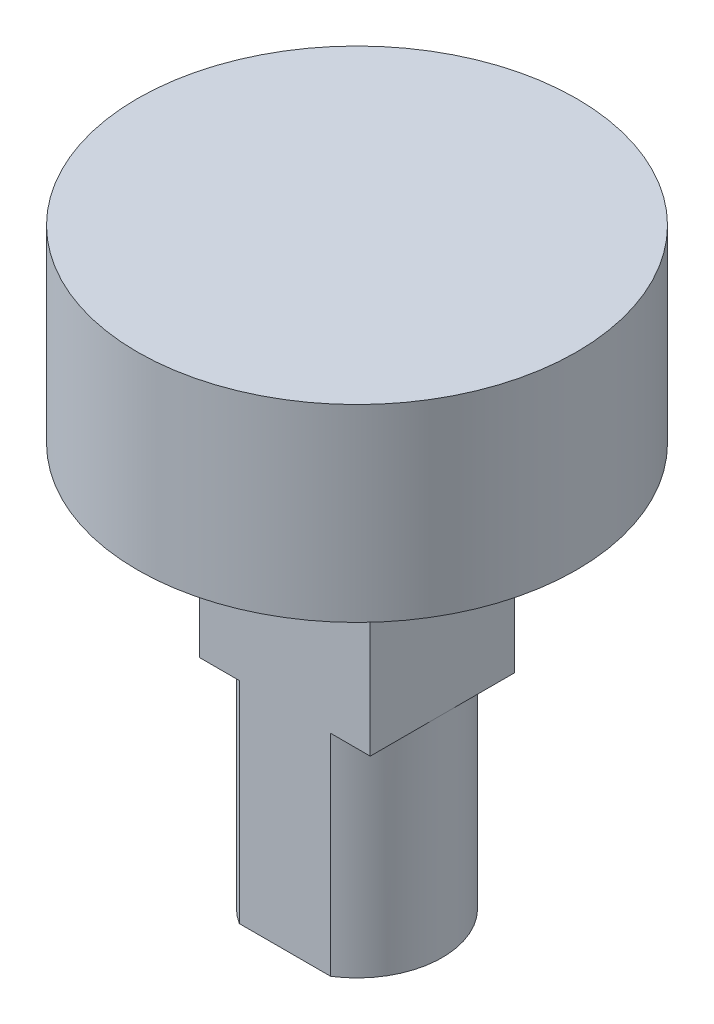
SolidWorks part; units mm, degrees
ref_plane "Front Plane" through (0, 0, 0) normal (0, 0, 1) x (1, 0, 0)
ref_plane "Top Plane" through (0, 0, 0) normal (0, 1, 0) x (1, 0, 0)
ref_plane "Right Plane" through (0, 0, 0) normal (1, 0, 0) x (0, 0, -1)
sketch "Sketch1" plane through (0, 0, 0) normal (0, 1, 0) x (1, 0, 0)
  line L1 (-5.969, -5.0419) -> (5.969, -5.0419)
  line L2 (-5.969, -5.0419) -> (-5.969, 5.0419)
  line L3 (-5.969, 5.0419) -> (5.969, 5.0419)
  line L4 (5.969, -5.0419) -> (5.969, 5.0419)
  line L5 (-5.969, -5.0419) -> (5.969, 5.0419) construction
  line L6 (-5.969, 5.0419) -> (5.969, -5.0419) construction
  point P0 (0, 0)
  dimension "D1" = 11.938
  dimension "D2" = 10.0838
extrude "Extrude1" add sketch "Sketch1" along normal blind 8.89
sketch "Sketch2" plane through (0, 0, 0) normal (0, -1, 0) x (1, 0, 0)
  line L0 (-5.969, 0) -> (5.969, 0) construction
  line L3 (0, -5.0419) -> (0, 5.0419) construction
  line L5 (5.969, -5.0419) -> (-5.969, -5.0419) construction
  line L6 (-5.969, 5.0419) -> (5.969, 5.0419) construction
  line L7 (-3.195, 5.0419) -> (3.195, 5.0419)
  line L8 (-3.195, -5.0419) -> (3.195, -5.0419)
  arc A0 (3.195, -5.0419) -> (3.195, 5.0419) centre (0, 0) ccw
  arc A1 (-3.195, -5.0419) -> (-3.195, 5.0419) centre (0, 0) cw
extrude "Extrude2" add sketch "Sketch2" along normal blind 14.732
sketch "Sketch3" plane through (0, 8.89, 0) normal (0, 1, 0) x (1, 0, 0)
  circle A0 centre (0, 0) radius 5.1943
  dimension "D1" = 10.3886
extrude "Extrude3" add sketch "Sketch3" along normal blind 4.572
sketch "Sketch5" plane through (0, 13.462, 0) normal (0, 1, 0) x (1, 0, 0)
  circle A0 centre (0, 0) radius 15.367
  dimension "D1" = 30.734
extrude "Extrude7" add sketch "Sketch5" along normal blind 13.208
